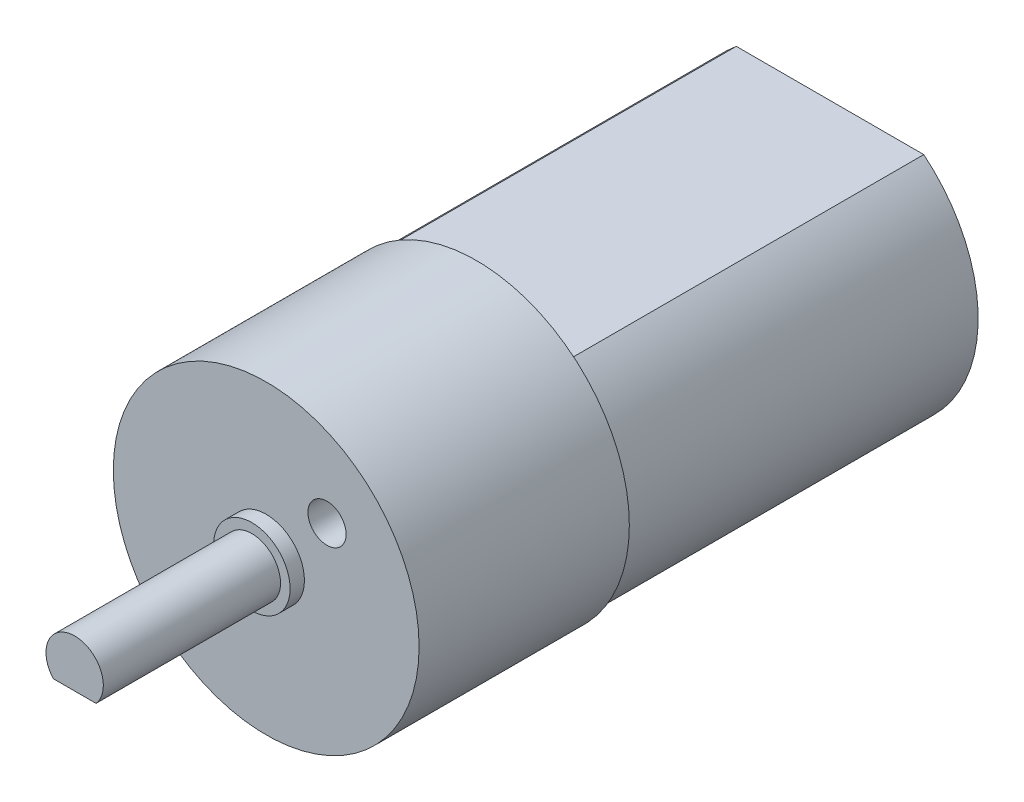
SolidWorks part; units mm, degrees
ref_plane "Alzado" through (0, 0, 0) normal (0, 0, 1) x (1, 0, 0)
ref_plane "Planta" through (0, 0, 0) normal (0, 1, 0) x (1, 0, 0)
ref_plane "Vista lateral" through (0, 0, 0) normal (1, 0, 0) x (0, 0, -1)
sketch "Croquis1" plane through (0, 0, 0) normal (0, 0, 1) x (1, 0, 0)
  circle A0 centre (0, 0) radius 8
  dimension "D1" = 16
extrude "Saliente-Extruir1" add sketch "Croquis1" along normal blind 11
ref_plane "Plano1" through (0, 0, 0) normal (0, 0, -1) x (-1, 0, 0)
sketch "Croquis2" plane through (0, 0, 0) normal (0, 0, -1) x (-1, 0, 0)
  circle A0 centre (0, 0) radius 7.75
  dimension "D1" = 15.5
extrude "Saliente-Extruir2" add sketch "Croquis2" along normal blind 18.5
sketch "Croquis3" plane through (0, 0, -18.5) normal (0, 0, -1) x (-1, 0, 0)
  line L0 (-4.9054, 6) -> (-4.9054, 7.6865)
  line L1 (-4.9054, -6) -> (4.9054, -6)
  line L2 (-4.9054, 7.6865) -> (-4.9054, 8.7161)
  line L3 (-4.9054, 6) -> (4.9054, 6)
  line L4 (-4.9054, 8.7161) -> (4.9054, 8.7161)
  line L5 (4.9054, 8.7161) -> (4.9054, 7.6865)
  line L8 (4.9054, 7.6865) -> (4.9054, 6)
  line L9 (4.9054, -6) -> (4.9054, -9.6312)
  line L10 (4.9054, -9.6312) -> (-4.9054, -9.6312)
  line L11 (-4.9054, -9.6312) -> (-4.9054, -6)
  circle A0 centre (0, 0) radius 7.75 construction
  point P0 (0, 0)
  dimension "D1" = 12
extrude "Cortar-Extruir1" cut sketch "Croquis3" against normal blind 18.5
ref_plane "Plano2" through (0, 0, 11) normal (0, 0, 1) x (1, 0, 0)
sketch "Croquis4" plane through (0, 0, 11) normal (0, 0, 1) x (1, 0, 0)
  circle A0 centre (0, 0) radius 2
  dimension "D1" = 4
extrude "Saliente-Extruir3" add sketch "Croquis4" along normal blind 0.75
ref_plane "Plano3" through (0, 0, 11.75) normal (0, 0, 1) x (1, 0, 0)
sketch "Croquis5" plane through (0, 0, 11.75) normal (0, 0, 1) x (1, 0, 0)
  circle A0 centre (0, 0) radius 1.5
  dimension "D1" = 3
extrude "Saliente-Extruir4" add sketch "Croquis5" along normal blind 15
sketch "Croquis6" plane through (0, 0, 26.75) normal (0, 0, 1) x (1, 0, 0)
  line L0 (0, 1.5) -> (0, -1) construction
  line L1 (-1.118, -1) -> (-1.118, -1.629)
  line L2 (1.118, -1) -> (1.118, -1.629)
  line L3 (1.118, -1.629) -> (-1.118, -1.629)
  line L4 (-1.118, -1) -> (1.118, -1)
  circle A0 centre (0, 0) radius 1.5 construction
  circle A1 centre (0, 0) radius 1.5 construction
  dimension "D1" = 2.5
extrude "Cortar-Extruir2" cut sketch "Croquis6" against normal blind 15
sketch "Croquis8" plane through (0, 0, 11) normal (0, 0, 1) x (1, 0, 0)
  line L0 (0, 0) -> (-3.182, -3.182) construction
  line L3 (0, 0) -> (3.182, 3.182) construction
  circle A1 centre (-3.182, -3.182) radius 1
  circle A2 centre (3.182, 3.182) radius 1
  dimension "D3" = 2
  dimension "D4" = 2
  dimension "D1" = 4.5
  dimension "D2" = 4.5
extrude "Cortar-Extruir3" cut sketch "Croquis8" against normal blind 5
sketch "Sketch1" plane through (0, -1, 0) normal (0, -1, 0) x (-1, 0, 0)
  line L0 (-2.2, -11.75) -> (2.2, -11.75) construction
  line L1 (-10.5453, -21.021) -> (14.7733, -21.021)
  line L2 (-10.5453, -21.021) -> (-10.5453, -35.0712)
  line L3 (-10.5453, -35.0712) -> (14.7733, -35.0712)
  line L4 (14.7733, -21.021) -> (14.7733, -35.0712)
  dimension "D1" = 9.271
extrude "Cut-Extrude1" cut sketch "Sketch1" against normal blind 10
